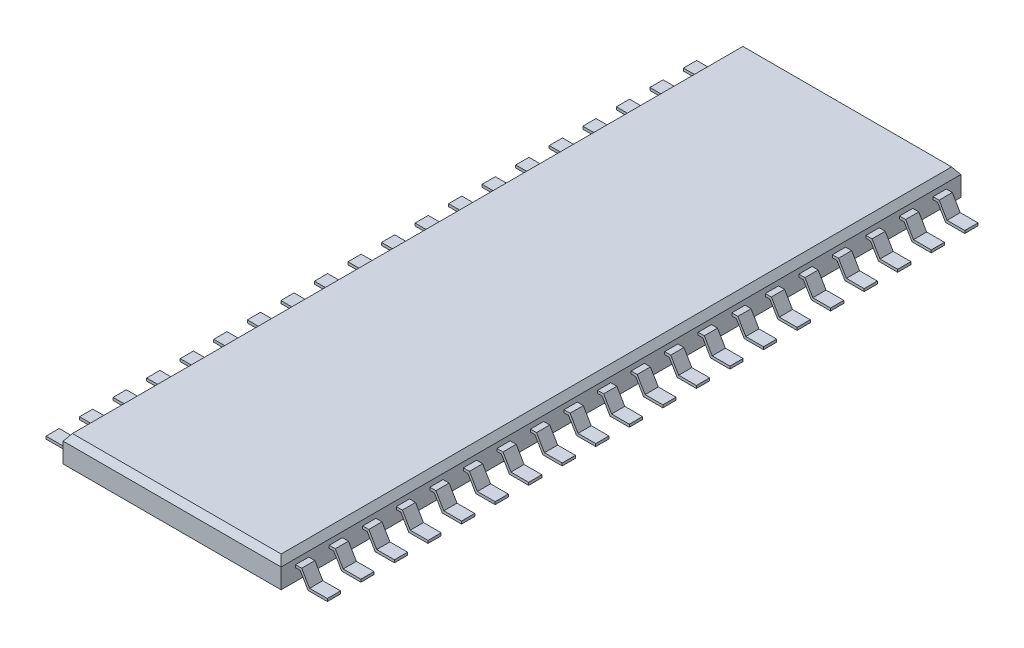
SolidWorks part; units mm, degrees
ref_plane "Front Plane" through (0, 0, 0) normal (0, 0, 1) x (1, 0, 0)
ref_plane "Top Plane" through (0, 0, 0) normal (0, 1, 0) x (1, 0, 0)
ref_plane "Right Plane" through (0, 0, 0) normal (1, 0, 0) x (0, 0, -1)
sketch "Sketch1" plane through (0, 0, 0) normal (0, 1, 0) x (1, 0, 0)
  line L0 (0, 6.8835) -> (0, -6.8835) construction
  line L1 (-5.5575, 0) -> (5.5575, 0) construction
  line L3 (-4.125, 13.5) -> (4.125, 13.5)
  line L4 (-4.125, 13.5) -> (-4.125, -13.5)
  line L5 (-4.125, -13.5) -> (4.125, -13.5)
  line L6 (4.125, 13.5) -> (4.125, -13.5)
  dimension "D1" = 8.25
  dimension "D2" = 27
extrude "Extrude1" add sketch "Sketch1" along normal mid plane 1
chamfer "Chamfer1" distance 0.25 angle 35 4 edges at (0, 0.5, -13.5) (4.125, 0.5, 0) (0, 0.5, 13.5) (-4.125, 0.5, 0)
sketch "Sketch4" plane through (0, 0, 0) normal (0, 0, 1) x (1, 0, 0)
  line L0 (0, 1.2724) -> (0, -0.9364) construction
  line L1 (-4.125, 1.8525) -> (-4.125, -1.3157) construction
  line L2 (-4.125, 0.25) -> (-4.125, -0.5) construction
  line L3 (0, 0) -> (-6.2695, 0) construction
  line L4 (-5.325, 1.2724) -> (-5.325, -1.1019) construction
  line L5 (-4.125, 0) -> (-4.325, 0)
  line L6 (-4.325, 0) -> (-4.625, -0.51)
  line L7 (-4.625, -0.51) -> (-5.325, -0.51)
  line L9 (-4.125, -0.5) -> (4.125, -0.5) construction
  point P19 (-4.325, 0)
  point P22 (-4.625, -0.51)
  dimension "D1" = 1.2
  dimension "D2" = 0.01
  dimension "D3" = 0.7
  dimension "D4" = 0.2
extrude "Extrude-Thin1" add sketch "Sketch4" along normal mid plane 0.5 thin
pattern_linear "LPattern1" count 11 spacing 1.27 along (0, 0, -1) count 10 spacing 1.27 along (0, 0, 1) of "Extrude-Thin1"
mirror "Mirror1" about plane through (0, 0, 0) normal (1, 0, 0) of "LPattern1", "Extrude-Thin1"
other "Move Face1" parameters "D1"=1.27
